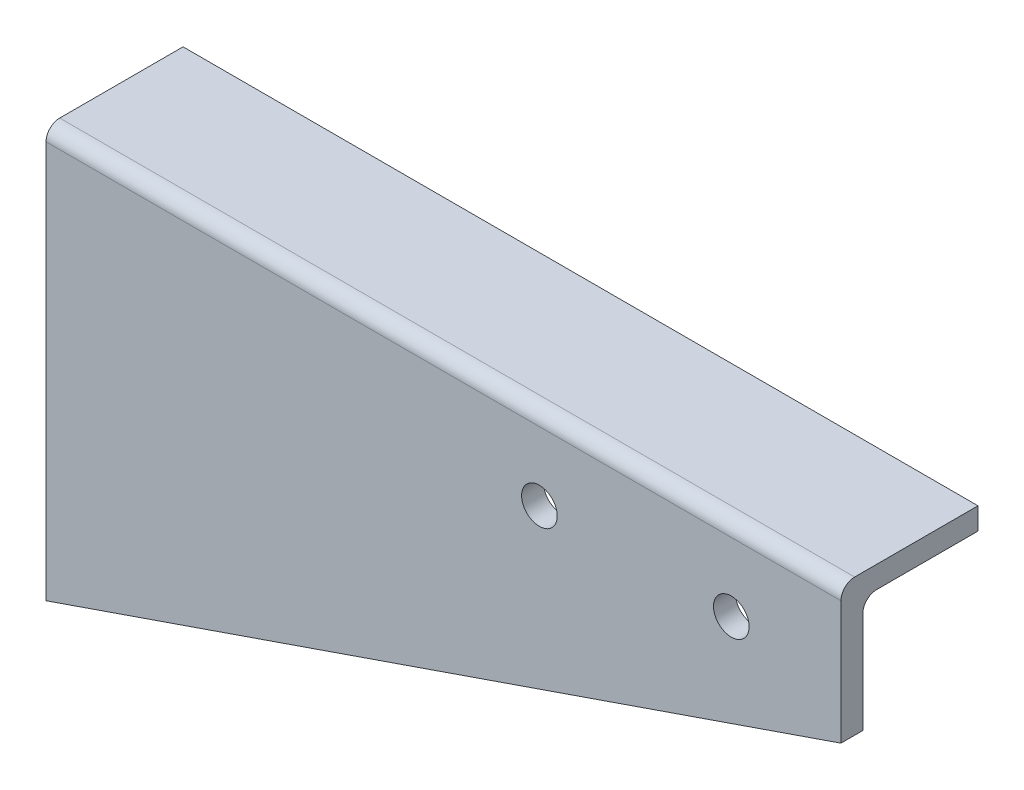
SolidWorks part; units mm, degrees
ref_plane "前视基准面" through (0, 0, 0) normal (0, 0, 1) x (1, 0, 0)
ref_plane "上视基准面" through (0, 0, 0) normal (0, 1, 0) x (1, 0, 0)
ref_plane "右视基准面" through (0, 0, 0) normal (1, 0, 0) x (0, 0, -1)
sketch "草图1" plane through (0, 0, 0) normal (0, 0, 1) x (1, 0, 0)
  line L0 (0, 0) -> (290, 0)
  line L1 (290, 0) -> (290, -50)
  line L2 (290, -50) -> (0, -150)
  line L3 (0, -150) -> (0, 0)
  dimension "D1" = 50
  dimension "D2" = 150
  dimension "D3" = 290
extrude "拉伸1" add sketch "草图1" along normal blind 8
sketch "草图2" plane through (0, 0, 0) normal (0, 0, -1) x (-1, 0, 0)
  line L0 (0, 0) -> (0, -150) construction
  line L1 (-290, 0) -> (0, 0)
  line L2 (-290, 0) -> (-290, -8)
  line L3 (-290, -8) -> (0, -8)
  line L4 (0, 0) -> (0, -8)
  dimension "D1" = 8
extrude "拉伸2" add sketch "草图2" along normal blind 42
sketch "草图3" plane through (0, 0, 8) normal (0, 0, 1) x (1, 0, 0)
  line L0 (290, 0) -> (0, 0) construction
  line L1 (290, -50) -> (290, 0) construction
  circle A0 centre (250, -30) radius 6.5
  circle A1 centre (180, -30) radius 6.5
  dimension "D1" = 70
  dimension "D2" = 13
  dimension "D3" = 13
  dimension "D4" = 30
  dimension "D5" = 40
extrude "切除-拉伸1" cut sketch "草图3" against normal through all
fillet "圆角1" radius 5 2 edges at (145, 0, 8)
